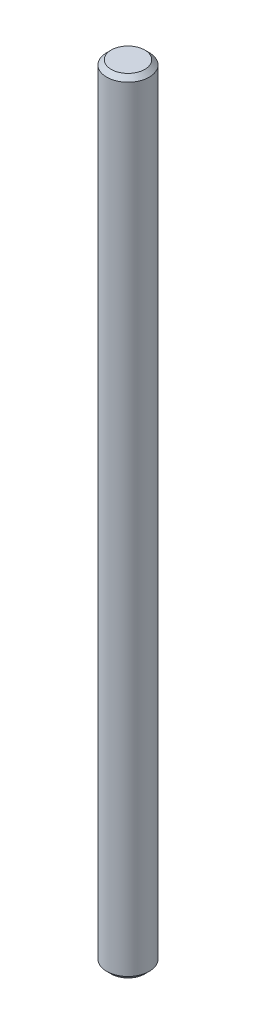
SolidWorks part; units mm, degrees
ref_plane "前视基准面" through (0, 0, 0) normal (0, 0, 1) x (1, 0, 0)
ref_plane "上视基准面" through (0, 0, 0) normal (0, 1, 0) x (1, 0, 0)
ref_plane "右视基准面" through (0, 0, 0) normal (1, 0, 0) x (0, 0, -1)
other "Configuration Table"
sketch "草图1" plane through (0, 0, 0) normal (0, 1, 0) x (1, 0, 0)
  circle A0 centre (0, 0) radius 0.95
  dimension "D1" = 1.9
extrude "凸台-拉伸1" add sketch "草图1" along normal blind 35
chamfer "倒角1" distance 0.2 angle 45 2 edges at (0, 0, 0.95) (0, 35, 0.95)
